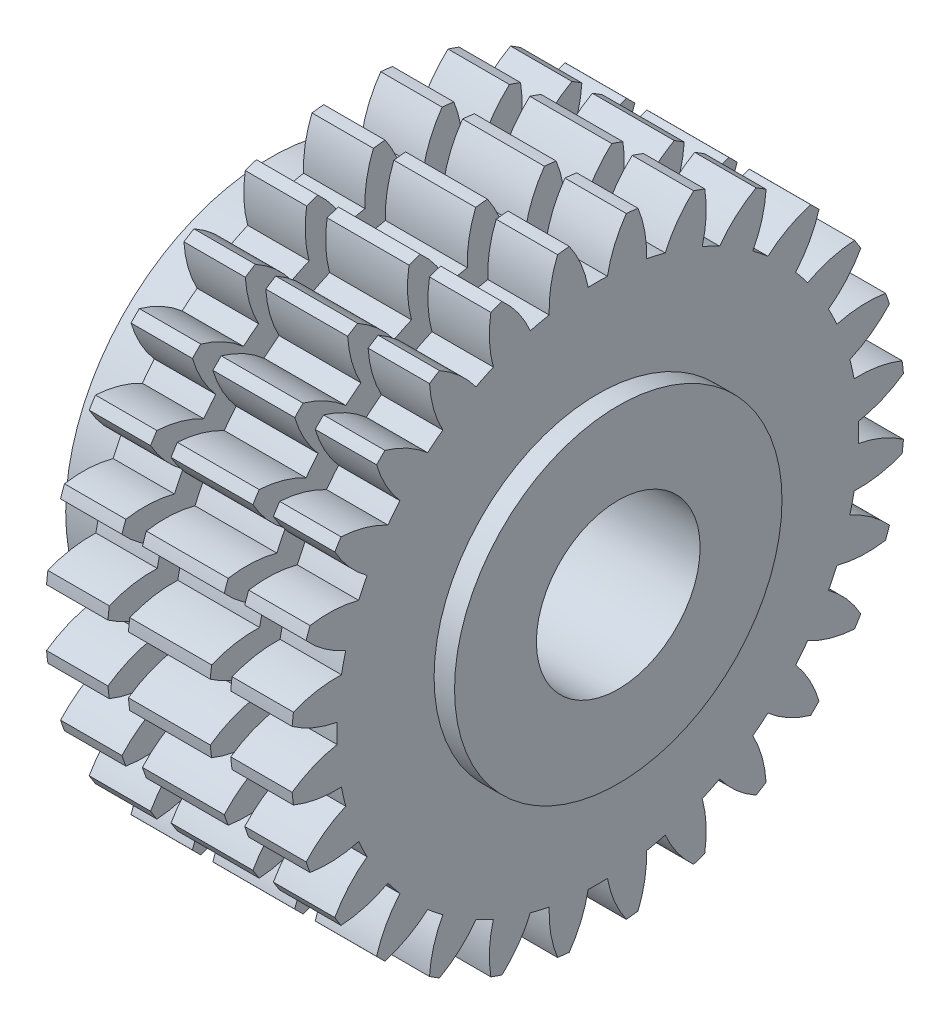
SolidWorks part; units mm, degrees
ref_plane "Plan de face" through (0, 0, 0) normal (0, 0, 1) x (1, 0, 0)
ref_plane "Plan de dessus" through (0, 0, 0) normal (0, 1, 0) x (1, 0, 0)
ref_plane "Plan de droite" through (0, 0, 0) normal (1, 0, 0) x (0, 0, -1)
imported_body "Importée1"
sketch "Esquisse1" plane through (6, 0, 0) normal (1, 0, 0) x (0, 0, -1)
  circle A0 centre (0, 0) radius 4
  circle A1 centre (0, 0) radius 2
  circle A2 centre (0, 0) radius 2 construction
  dimension "D1" = 8
extrude "Boss.-Extru.1" add sketch "Esquisse1" along normal blind 0.5
